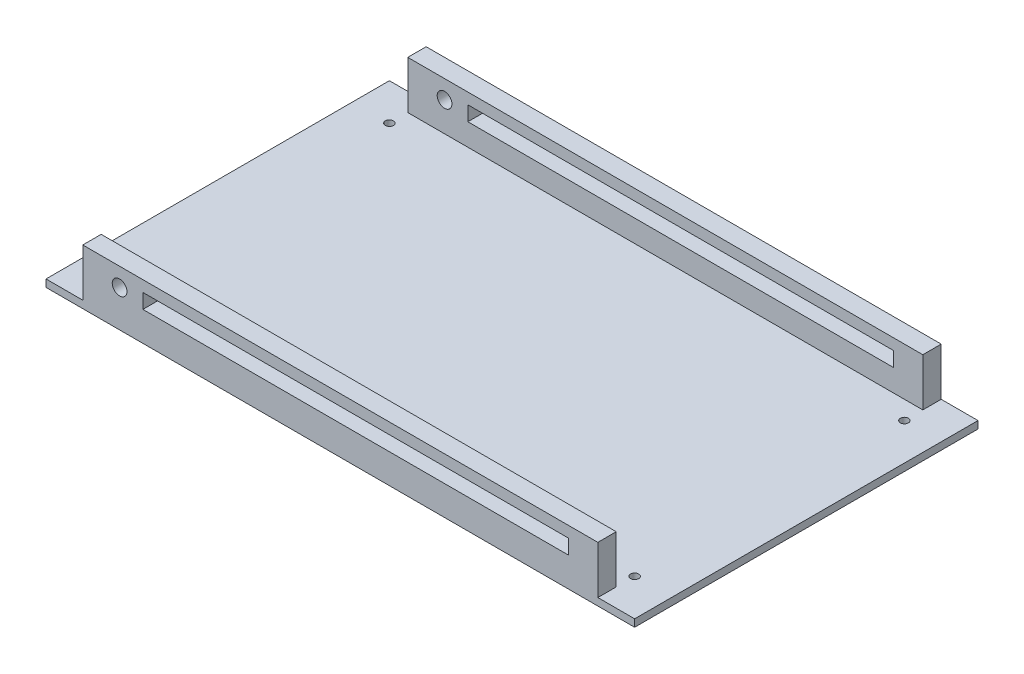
SolidWorks part; units mm, degrees
ref_plane "前视基准面" through (0, 0, 0) normal (0, 0, 1) x (1, 0, 0)
ref_plane "上视基准面" through (0, 0, 0) normal (0, 1, 0) x (1, 0, 0)
ref_plane "右视基准面" through (0, 0, 0) normal (1, 0, 0) x (0, 0, -1)
other "Configuration Table"
sketch "草图1" plane through (0, 0, 0) normal (0, 0, 1) x (1, 0, 0)
  line L1 (-240, 20) -> (240, 20)
  line L2 (-240, 20) -> (-240, 26)
  line L3 (-240, 26) -> (240, 26)
  line L4 (240, 20) -> (240, 26)
  line L5 (-240, 20) -> (240, 26) construction
  line L6 (-240, 26) -> (240, 20) construction
  point P0 (0, 23)
  dimension "D1" = 240
  dimension "D2" = 20
  dimension "D3" = 23
extrude "Mount_Plate_480x280x6" add sketch "草图1" against normal mid plane 280
sketch "草图2" plane through (0, 0, 0) normal (0, 0, 1) x (1, 0, 0)
  line L1 (-210, 26) -> (210, 26)
  line L2 (-210, 26) -> (-210, 65)
  line L3 (-210, 65) -> (210, 65)
  line L4 (210, 26) -> (210, 65)
  line L5 (-210, 26) -> (210, 65) construction
  line L6 (-210, 65) -> (210, 26) construction
  point P0 (0, 45.5)
  dimension "D1" = 210
  dimension "D2" = 26
  dimension "D3" = 45.5
extrude "Guide_Rails_Blank" add sketch "草图2" against normal mid plane 280
sketch "草图3" plane through (0, 0, 0) normal (0, 0, 1) x (1, 0, 0)
  line L1 (-215, 26) -> (215, 26)
  line L2 (-215, 26) -> (-215, 66)
  line L3 (-215, 66) -> (215, 66)
  line L4 (215, 26) -> (215, 66)
  line L5 (-215, 26) -> (215, 66) construction
  line L6 (-215, 66) -> (215, 26) construction
  point P0 (0, 46)
  dimension "D1" = 215
  dimension "D2" = 26
  dimension "D3" = 46
extrude "Open_Centre_Above_Mount" cut sketch "草图3" against normal mid plane 250
sketch "草图4" plane through (0, 0, 0) normal (0, 0, 1) x (1, 0, 0)
  circle A0 centre (-180, 50) radius 6
  dimension "D1" = 12
  dimension "D2" = 180
  dimension "D3" = 50
extrude "Fixed_Pivot_D12_Xminus180" cut sketch "草图4" against normal mid plane 1000
sketch "草图5" plane through (0, 0, 0) normal (0, 0, 1) x (1, 0, 0)
  line L1 (-161, 44) -> (186, 44)
  line L2 (-161, 44) -> (-161, 56)
  line L3 (-161, 56) -> (186, 56)
  line L4 (186, 44) -> (186, 56)
  line L5 (-161, 44) -> (186, 56) construction
  line L6 (-161, 56) -> (186, 44) construction
  point P0 (12.5, 50)
  dimension "D1" = 12.5
  dimension "D2" = 186
  dimension "D3" = 44
  dimension "D4" = 50
extrude "Sliding_Guide_12x347" cut sketch "草图5" against normal mid plane 1000
sketch "草图6" plane through (0, 0, 0) normal (0, 1, 0) x (1, 0, 0)
  circle A0 centre (-210, -110) radius 3.3
  circle A1 centre (-210, 110) radius 3.3
  circle A2 centre (210, -110) radius 3.3
  circle A3 centre (210, 110) radius 3.3
  dimension "D1" = 6.6
  dimension "D2" = 210
  dimension "D3" = 210
  dimension "D4" = 110
  dimension "D5" = 110
extrude "Four_M6_Clearance_D6p6_420x220" cut sketch "草图6" against normal mid plane 100
